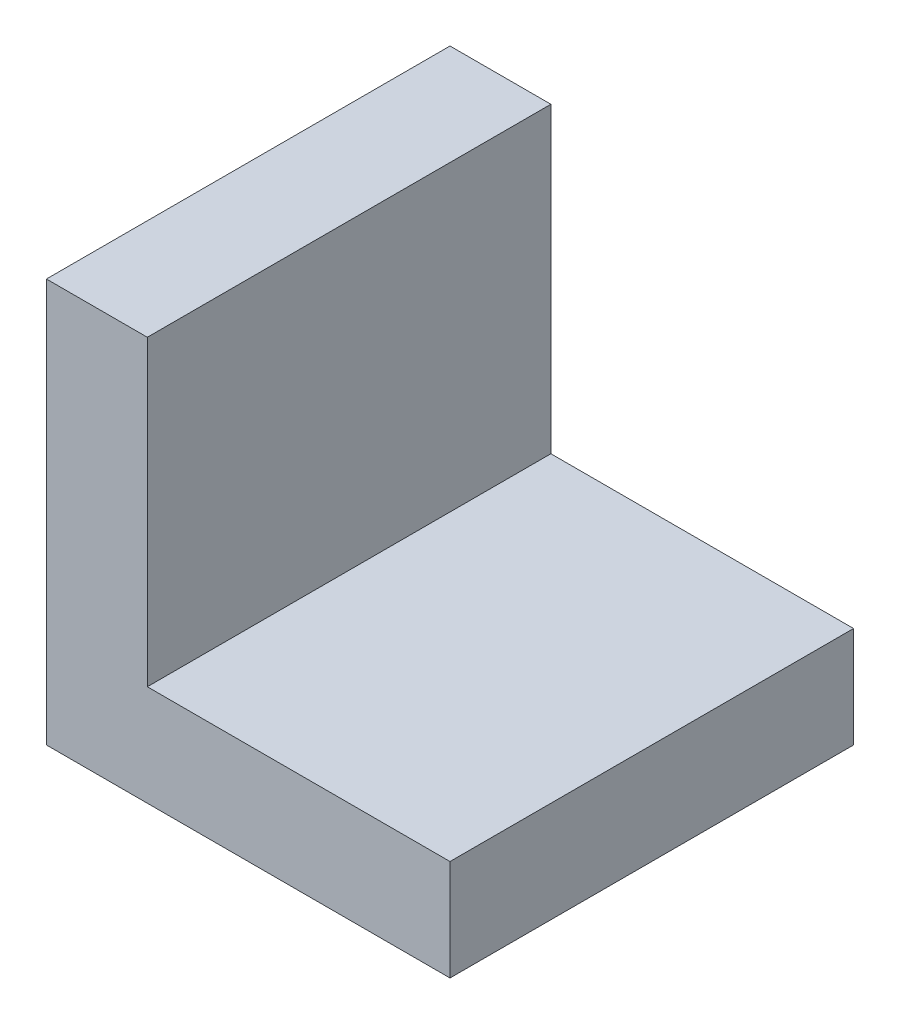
SolidWorks part; units mm, degrees
ref_plane "Front Plane" through (0, 0, 0) normal (0, 0, 1) x (1, 0, 0)
ref_plane "Top Plane" through (0, 0, 0) normal (0, 1, 0) x (1, 0, 0)
ref_plane "Right Plane" through (0, 0, 0) normal (1, 0, 0) x (0, 0, -1)
sketch "Sketch1" plane through (0, 0, 0) normal (0, 0, 1) x (1, 0, 0)
  line L0 (0, 100) -> (0, 0)
  line L1 (0, 0) -> (100, 0)
  line L2 (100, 0) -> (100, 25)
  line L3 (100, 25) -> (25, 25)
  line L4 (25, 25) -> (25, 100)
  line L5 (25, 100) -> (0, 100)
  dimension "D1" = 100
  dimension "D2" = 25
extrude "Boss-Extrude1" add sketch "Sketch1" along normal blind 100
